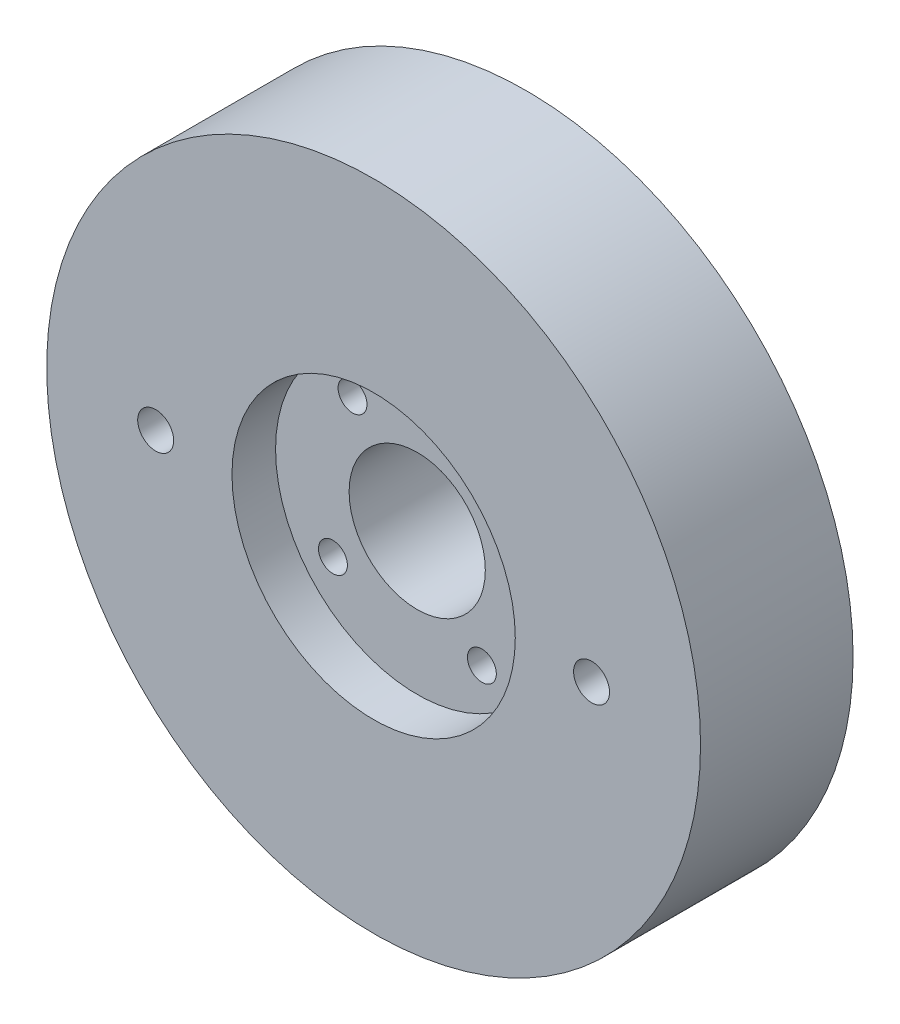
SolidWorks part; units mm, degrees
ref_plane "Plan de face" through (0, 0, 0) normal (0, 0, 1) x (1, 0, 0)
ref_plane "Plan de dessus" through (0, 0, 0) normal (0, 1, 0) x (1, 0, 0)
ref_plane "Plan de droite" through (0, 0, 0) normal (1, 0, 0) x (0, 0, -1)
sketch "Esquisse1" plane through (0, 0, 0) normal (0, 0, 1) x (1, 0, 0)
  circle A0 centre (0, 0) radius 60
extrude "Boss.-Extru.1" add sketch "Esquisse1" along normal blind 28
sketch "Esquisse2" plane through (0, 0, 28) normal (0, 0, 1) x (1, 0, 0)
  circle A0 centre (0, 0) radius 26
extrude "Enlèv. mat.-Extru.1" cut sketch "Esquisse2" against normal blind 8
sketch "Esquisse22" [suppressed] plane through (0, 0, 27) normal (0, 0, 1) x (1, 0, 0)
  line L0 (60, 0) -> (-60, 0) construction
  circle A0 centre (0, 0) radius 60 construction
  point P3 (40, 0)
  point P6 (-40, 0)
  dimension "D1" = 40
  dimension "D2" = 80
hole_wizard "Dégagement M62" positions "Esquisse26" profile "Esquisse25" hole size "M6" standard "ISO"
sketch "Esquisse26" plane through (0, 0, 28) normal (0, 0, 1) x (1, 0, 0)
  point P0 (-40, 0)
  point P1 (40, 0)
sketch "Esquisse25" plane through (-40, 0, 28) normal (1, 0, 0) x (0, -1, 0)
  line L0 (0, 0) -> (0, 28)
  line L1 (0, 28) -> (3.3, 28)
  line L2 (3.3, 28) -> (3.3, 0)
  line L5 (3.3, 0) -> (0, 0)
  line L11 (0, -6.35) -> (0, 107.95) construction
  dimension "Diamètre du perçage jusqu'au prochain" = 6.6
  dimension "Profondeur du perçage jusqu'au prochain" = 28
sketch "Esquisse27" plane through (0, 0, 20) normal (0, 0, 1) x (1, 0, 0)
  line L0 (0, 0) -> (34.8109, 0) construction
  point P3 (19.5, 0)
  dimension "D1" = 19.5
hole_wizard "Diamètre du perçage Ø4.0 (4)2" positions "Esquisse31" profile "Esquisse30" hole size "Ø4.0" standard "ISO"
sketch "Esquisse31" plane through (0, 0, 20) normal (0, 0, 1) x (1, 0, 0)
  point P0 (19.5, 0)
sketch "Esquisse30" plane through (19.5, 0, 20) normal (1, 0, 0) x (0, -1, 0)
  line L0 (0, 0) -> (0, 11.2017)
  line L1 (0, 11.2017) -> (2, 10)
  line L2 (2, 10) -> (2, 0)
  line L5 (2, 0) -> (0, 0)
  line L10 (0, 11.2017) -> (-2, 10) construction
  line L11 (0, -6.35) -> (0, 107.95) construction
  dimension "Diamètre du perçage" = 4
  dimension "Profondeur du perçage" = 10
  dimension "Angle de pointe" = 118
sketch "Esquisse4" plane through (0, 0, 0) normal (0, 0, -1) x (-1, 0, 0)
  line L0 (0, 60) -> (0, -60) construction
  line L1 (60, 0) -> (-60, 0) construction
  line L2 (0, 0) -> (-15.4704, 11.8708) construction
  line L3 (0, 0) -> (11.8708, 15.4704) construction
  line L4 (0, 0) -> (-11.8708, -15.4704) construction
  line L5 (0, 0) -> (15.4704, -11.8708) construction
  circle A0 centre (0, 0) radius 19.5 construction
  circle A1 centre (0, 0) radius 60 construction
  point P10 (-19.5, 0)
  dimension "D1" = 52.5
  dimension "D2" = 90
  dimension "D3" = 90
  dimension "D4" = 90
sketch "Esquisse9" plane through (0, 0, 0) normal (0, 0, -1) x (-1, 0, 0)
  circle A0 centre (0, 0) radius 12.5
extrude "Enlèv. mat.-Extru.4" cut sketch "Esquisse9" against normal through all
hole_wizard "Diamètre du perçage Ø5.3 (5.3)1" positions "Esquisse6" profile "Esquisse5" hole size "Ø5.3" standard "ISO"
sketch "Esquisse6" plane through (0, 0, 0) normal (0, 0, -1) x (-1, 0, 0)
  point P0 (-15.4704, 11.8708)
  point P1 (-11.8708, -15.4704)
  point P4 (15.4704, -11.8708)
  point P7 (11.8708, 15.4704)
sketch "Esquisse5" plane through (15.4704, 11.8708, 0) normal (1, 0, 0) x (0, 1, 0)
  line L0 (0, 0) -> (0, 28)
  line L1 (0, 28) -> (2.65, 28)
  line L2 (2.65, 28) -> (2.65, 0)
  line L5 (2.65, 0) -> (0, 0)
  line L11 (0, -6.35) -> (0, 107.95) construction
  dimension "Diamètre du perçage jusqu'au prochain" = 5.3
  dimension "Profondeur du perçage jusqu'au prochain" = 28
sketch "Esquisse7" plane through (0, 0, 0) normal (0, 0, -1) x (-1, 0, 0)
  circle A0 centre (-15.4704, 11.8708) radius 5
  circle A1 centre (11.8708, 15.4704) radius 5
  circle A2 centre (-11.8708, -15.4704) radius 5
  circle A3 centre (15.4704, -11.8708) radius 5
extrude "Enlèv. mat.-Extru.3" cut sketch "Esquisse7" against normal blind 7.5
sketch "Esquisse11" plane through (0, 0, 0) normal (0, 0, -1) x (-1, 0, 0)
  circle A0 centre (0, 0) radius 60
extrude "Enlèv. mat.-Extru.6" [suppressed] cut sketch "Esquisse11" against normal blind 1.5
sketch "Esquisse12" [suppressed] plane through (0, 0, 1.5) normal (0, 0, -1) x (-1, 0, 0)
  line L0 (-10, 28.0746) -> (-10, 55)
  line L1 (-10, 55) -> (10, 55)
  line L2 (10, 55) -> (10, 28.0746)
  line L3 (-10, -28.0746) -> (-10, -55)
  line L4 (-10, -55) -> (10, -55)
  line L5 (10, -55) -> (10, -28.0746)
  line L6 (60, 0) -> (-60, 0) construction
  line L7 (0, 60) -> (0, -60) construction
  arc A0 (-10, 28.0746) -> (-10, -28.0746) centre (0, 0) ccw
  arc A1 (10, -28.0746) -> (10, 28.0746) centre (0, 0) ccw
  dimension "D1" = 110
  dimension "D2" = 55
  dimension "D3" = 10
  dimension "D4" = 20
  dimension "D5" = 20
extrude "Enlèv. mat.-Extru.7" [suppressed] cut sketch "Esquisse12" against normal through all flip side to cut
fillet "Congé2" [suppressed] radius 6
chamfer "Chanfrein2" [suppressed] distance 15 angle 45
chamfer "Chanfrein3" [suppressed] distance 15 angle 45
sketch "Esquisse14" [suppressed] plane through (0, 19.25, -19.25) normal (0, 0.7071, -0.7071) x (1, 0, 0)
  line L0 (-10, -50.5581) -> (-10, -29.3449) construction
  line L1 (7.5, -57.3449) -> (-7.5, -57.3449)
  line L2 (7.5, -57.3449) -> (7.5, -22.3449)
  line L3 (7.5, -22.3449) -> (-7.5, -22.3449)
  line L4 (-7.5, -57.3449) -> (-7.5, -22.3449)
  line L5 (-10, -29.3449) -> (10, -29.3449) construction
  dimension "D1" = 15
  dimension "D2" = 2.5
  dimension "D3" = 35
  dimension "D4" = 7
extrude "Enlèv. mat.-Extru.9" [suppressed] cut sketch "Esquisse14" against normal blind 3
sketch "Esquisse15" [suppressed] plane through (0, -19.25, -19.25) normal (0, -0.7071, -0.7071) x (1, 0, 0)
  line L0 (10, 29.3449) -> (-10, 29.3449) construction
  line L1 (-7.5, 57.3449) -> (7.5, 57.3449)
  line L2 (-7.5, 57.3449) -> (-7.5, 22.3449)
  line L3 (-7.5, 22.3449) -> (7.5, 22.3449)
  line L4 (7.5, 57.3449) -> (7.5, 22.3449)
  line L5 (10, 50.5581) -> (10, 29.3449) construction
  dimension "D1" = 15
  dimension "D2" = 35
  dimension "D3" = 7
  dimension "D4" = 2.5
extrude "Enlèv. mat.-Extru.10" [suppressed] cut sketch "Esquisse15" against normal blind 3
chamfer "Chanfrein4" [suppressed] distance 15 angle 45
chamfer "Chanfrein5" [suppressed] distance 15 angle 45
hole_wizard "Trou taraudé M101" positions "Esquisse17" profile "Esquisse16" tap size "M10" standard "ISO"
sketch "Esquisse17" [suppressed] plane through (0, -17.1287, -17.1287) normal (0, -0.7071, -0.7071) x (1, 0, 0)
  line L0 (-7.5, 47.3762) -> (-7.5, 26.3449) construction
  line L1 (7.5, 47.3762) -> (-7.5, 47.3762) construction
  point P0 (0, 36.8762)
  dimension "D1" = 7.5
  dimension "D2" = 10.5
sketch "Esquisse16" plane through (0, -43.2041, 8.9467) normal (1, 0, 0) x (0, 0.7071, -0.7071)
  line L0 (0, 0) -> (0, 20.0537)
  line L1 (0, 20.0537) -> (4.25, 17.5)
  line L2 (4.25, 17.5) -> (4.25, 0)
  line L5 (4.25, 0) -> (0, 0)
  line L10 (0, 20.0537) -> (-4.25, 17.5) construction
  line L11 (0, -6.35) -> (0, 107.95) construction
  dimension "Diamètre du trou pour taraudage" = 8.5
  dimension "Profondeur du trou pour taraudage" = 17.5
  dimension "Angle de pointe" = 118
hole_wizard "Trou taraudé M102" positions "Esquisse19" profile "Esquisse18" tap size "M10" standard "ISO"
sketch "Esquisse19" [suppressed] plane through (0, 17.1287, -17.1287) normal (0, 0.7071, -0.7071) x (-1, 0, 0)
  line L0 (7.5, 47.3762) -> (-7.5, 47.3762) construction
  line L1 (7.5, 26.3449) -> (7.5, 47.3762) construction
  point P0 (0, 36.8762)
  dimension "D1" = 10.5
  dimension "D2" = 7.5
sketch "Esquisse18" [suppressed] plane through (0, 43.2041, 8.9467) normal (1, 0, 0) x (0, 0.7071, 0.7071)
  line L0 (0, 0) -> (0, 20.0537)
  line L1 (0, 20.0537) -> (4.25, 17.5)
  line L2 (4.25, 17.5) -> (4.25, 0)
  line L5 (4.25, 0) -> (0, 0)
  line L10 (0, 20.0537) -> (-4.25, 17.5) construction
  line L11 (0, -6.35) -> (0, 107.95) construction
  dimension "Diamètre du trou pour taraudage" = 8.5
  dimension "Profondeur du trou pour taraudage" = 17.5
  dimension "Angle de pointe" = 118
chamfer "Chanfrein6" distance 0.5 angle 45 1 edges at (21.5, 0, 20)
